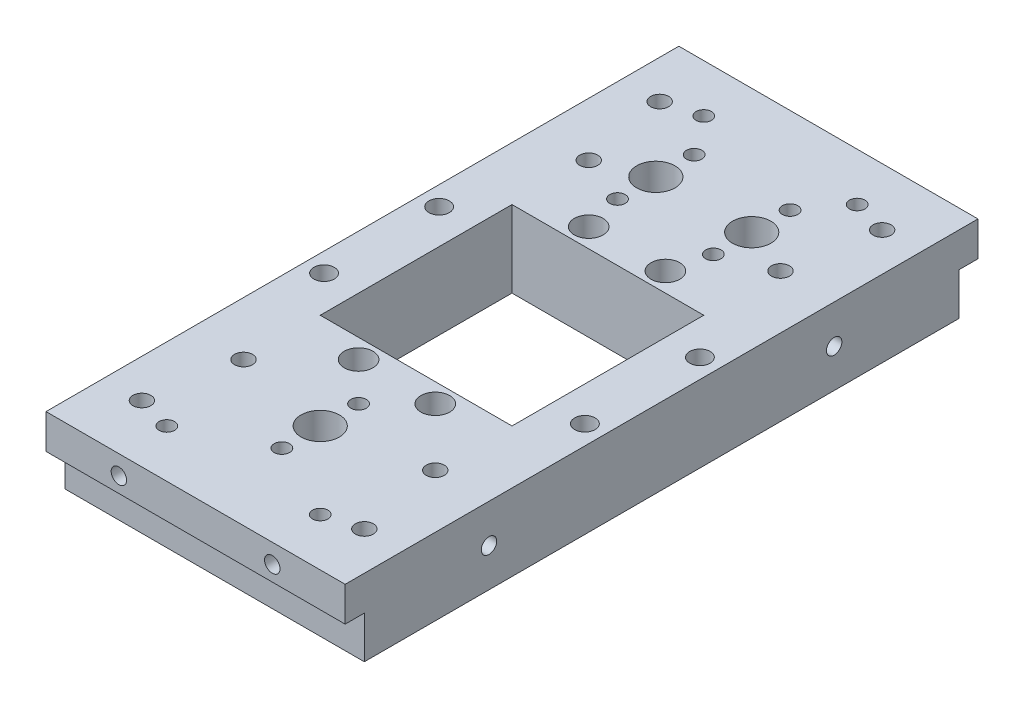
SolidWorks part; units mm, degrees
ref_plane "Front Plane" through (0, 0, 0) normal (0, 0, 1) x (1, 0, 0)
ref_plane "Top Plane" through (0, 0, 0) normal (0, 1, 0) x (1, 0, 0)
ref_plane "Right Plane" through (0, 0, 0) normal (1, 0, 0) x (0, 0, -1)
sketch "Sketch1" plane through (0, 0, 0) normal (0, 1, 0) x (1, 0, 0)
  line L1 (-49.53, 104.775) -> (49.53, 104.775)
  line L2 (-49.53, 104.775) -> (-49.53, -104.775)
  line L3 (-49.53, -104.775) -> (49.53, -104.775)
  line L4 (49.53, 104.775) -> (49.53, -104.775)
  dimension "D1" = 49.53
  dimension "D2" = 49.53
  dimension "D3" = 104.775
  dimension "D4" = 104.775
extrude "Boss-Extrude1" add sketch "Sketch1" along normal mid plane 25.4
sketch "Sketch2" plane through (0, 12.7, 0) normal (0, 1, 0) x (1, 0, 0)
  line L1 (-31.75, 31.75) -> (31.75, 31.75)
  line L2 (-31.75, 31.75) -> (-31.75, -31.75)
  line L3 (-31.75, -31.75) -> (31.75, -31.75)
  line L4 (31.75, 31.75) -> (31.75, -31.75)
  dimension "D1" = 31.75
  dimension "D2" = 31.75
  dimension "D3" = 31.75
  dimension "D4" = 31.75
extrude "Cut-Extrude1" cut sketch "Sketch2" against normal blind 25.4
hole_wizard "1/4-20 Tapped Hole1" positions "Sketch5" profile "Sketch4" tap size "1/4-20" standard "ANSI Inch"
sketch "Sketch5" plane through (0, 0, 104.775) normal (0, 0, 1) x (1, 0, 0)
  line L0 (-49.53, 12.7) -> (49.53, 12.7) construction
  point P0 (-25.4, 6.35)
  point P2 (25.4, 6.35)
  dimension "D1" = 25.4
  dimension "D2" = 25.4
  dimension "D3" = 6.35
sketch "Sketch4" plane through (-25.4, 6.35, 104.775) normal (1, 0, 0) x (0, -1, 0)
  line L0 (0, 0) -> (0, 20.5838)
  line L1 (0, 20.5838) -> (2.5527, 19.05)
  line L2 (2.5527, 19.05) -> (2.5527, 0)
  line L5 (2.5527, 0) -> (0, 0)
  line L10 (0, 20.5838) -> (-2.5527, 19.05) construction
  line L11 (0, -6.35) -> (0, 107.95) construction
  dimension "Tap Drill Dia." = 5.1054
  dimension "Tap Drill Depth" = 19.05
  dimension "Drill Angle" = 118
hole_wizard "CBORE for 1/4 Socket Head Cap Screw1" positions "Sketch7" profile "Sketch6" counterbore size "1/4" standard "ANSI Inch"
sketch "Sketch7" plane through (0, -12.7, 0) normal (0, -1, 0) x (-1, 0, 0)
  point P0 (43.18, 19.05)
  point P2 (43.18, -19.05)
  point P4 (-43.18, -19.05)
  point P6 (-43.18, 19.05)
  dimension "D1" = 19.05
  dimension "D2" = 19.05
  dimension "D3" = 43.18
  dimension "D4" = 43.18
sketch "Sketch6" plane through (-43.18, -12.7, -19.05) normal (1, 0, 0) x (0, 0, -1)
  line L0 (0, 0) -> (0, 25.4)
  line L1 (0, 25.4) -> (3.3782, 25.4)
  line L3 (3.3782, 25.4) -> (3.3782, 6.35)
  line L4 (3.3782, 6.35) -> (5.5562, 6.35)
  line L5 (5.5562, 6.35) -> (5.5562, 0)
  line L7 (5.5562, 0) -> (0, 0)
  line L11 (0, -6.35) -> (0, 107.95) construction
  dimension "Thru Hole Dia." = 6.7564
  dimension "Thru Hole Depth" = 25.4
  dimension "C'Bore Dia." = 11.1125
  dimension "C'Bore Depth" = 6.35
hole_wizard "15/64 (0.23438) Diameter Hole1" positions "Sketch9" profile "Sketch8" hole size "15/64" standard "ANSI Inch"
sketch "Sketch9" plane through (0, 12.7, 0) normal (0, 1, 0) x (1, 0, 0)
  line L0 (49.53, -104.775) -> (49.53, 104.775) construction
  line L1 (-49.53, 104.775) -> (-49.53, -104.775) construction
  line L2 (49.53, 104.775) -> (-49.53, 104.775) construction
  line L3 (-49.53, -104.775) -> (49.53, -104.775) construction
  line L4 (31.75, 31.75) -> (-31.75, 31.75) construction
  line L5 (-31.75, -31.75) -> (31.75, -31.75) construction
  point P0 (-36.83, 85.725)
  point P2 (36.83, 85.725)
  point P4 (36.83, -85.725)
  point P6 (-36.83, -85.725)
  point P18 (-31.75, -57.15)
  point P20 (31.75, -57.15)
  point P22 (31.75, 57.15)
  point P24 (-31.75, 57.15)
  dimension "D1" = 12.7
  dimension "D2" = 12.7
  dimension "D3" = 19.05
  dimension "D4" = 19.05
  dimension "D5" = 31.75
  dimension "D6" = 31.75
  dimension "D7" = 25.4
  dimension "D8" = 25.4
sketch "Sketch8" plane through (-36.83, 12.7, -85.725) normal (1, 0, 0) x (0, 0, 1)
  line L0 (0, 0) -> (0, 25.4)
  line L1 (0, 25.4) -> (2.9766, 25.4)
  line L2 (2.9766, 25.4) -> (2.9766, 0)
  line L5 (2.9766, 0) -> (0, 0)
  line L11 (0, -6.35) -> (0, 107.95) construction
  dimension "Thru Hole Dia." = 5.9533
  dimension "Thru Hole Depth" = 25.4
hole_wizard "1/2 (0.5) Diameter Hole1" positions "Sketch11" profile "Sketch10" hole size "1/2" standard "ANSI Inch"
sketch "Sketch11" plane through (0, 12.7, 0) normal (0, 1, 0) x (1, 0, 0)
  point P0 (0, -63.5)
  point P2 (-15.875, 63.5)
  point P4 (15.875, 63.5)
  dimension "D1" = 15.875
  dimension "D2" = 15.875
  dimension "D3" = 63.5
  dimension "D4" = 63.5
sketch "Sketch10" plane through (0, 12.7, 63.5) normal (1, 0, 0) x (0, 0, 1)
  line L0 (0, 0) -> (0, 25.4)
  line L1 (0, 25.4) -> (6.35, 25.4)
  line L2 (6.35, 25.4) -> (6.35, 0)
  line L5 (6.35, 0) -> (0, 0)
  line L11 (0, -6.35) -> (0, 107.95) construction
  dimension "Thru Hole Dia." = 12.7
  dimension "Thru Hole Depth" = 25.4
mirror "Mirror1" about plane through (0, 0, 0) normal (0, 0, 1) of "1/4-20 Tapped Hole1"
hole_wizard "1/4-20 Tapped Hole4" positions "Sketch13" profile "Sketch12" tap size "1/4-20" standard "ANSI Inch"
sketch "Sketch13" plane through (49.53, 0, 0) normal (1, 0, 0) x (0, 0, -1)
  point P0 (-57.15, 0)
  point P2 (57.15, 0)
  dimension "D1" = 57.15
  dimension "D2" = 57.15
sketch "Sketch12" plane through (49.53, 0, 57.15) normal (0, 1, 0) x (0, 0, -1)
  line L0 (0, 0) -> (0, 21.8538)
  line L1 (0, 21.8538) -> (2.5527, 20.32)
  line L2 (2.5527, 20.32) -> (2.5527, 0)
  line L5 (2.5527, 0) -> (0, 0)
  line L10 (0, 21.8538) -> (-2.5527, 20.32) construction
  line L11 (0, -6.35) -> (0, 107.95) construction
  dimension "Tap Drill Dia." = 5.1054
  dimension "Tap Drill Depth" = 20.32
  dimension "Drill Angle" = 118
mirror "Mirror2" about plane through (0, 0, 0) normal (1, 0, 0) of "1/4-20 Tapped Hole4"
sketch "Sketch15" plane through (0, 12.7, 0) normal (0, 1, 0) x (1, 0, 0)
  circle A0 centre (12.7, -38.1) radius 4.7625
  circle A1 centre (-12.7, -38.1) radius 4.7625
  dimension "D1" = 12.7
  dimension "D2" = 12.7
  dimension "D3" = 38.1
extrude "Cut-Extrude2" cut sketch "Sketch15" against normal up to next
mirror "Mirror3" about plane through (0, 0, 0) normal (0, 0, 1) of "Cut-Extrude2"
hole_wizard "1/4-20 Tapped Hole5" positions "Sketch17" profile "Sketch16" tap size "1/4-20" standard "ANSI Inch"
sketch "Sketch17" plane through (0, 12.7, 0) normal (0, 1, 0) x (1, 0, 0)
  circle A0 centre (0, -63.5) radius 6.35 construction
  circle A1 centre (15.875, 63.5) radius 6.35 construction
  point P0 (0, -76.2)
  point P2 (0, -50.8)
  point P4 (15.875, 50.8)
  point P6 (15.875, 76.2)
  point P8 (-15.875, 50.8)
  point P10 (-15.875, 76.2)
  dimension "D1" = 12.7
  dimension "D2" = 12.7
  dimension "D3" = 12.7
  dimension "D4" = 12.7
  dimension "D5" = 15.875
  dimension "D6" = 15.875
sketch "Sketch16" plane through (0, 12.7, 76.2) normal (1, 0, 0) x (0, 0, 1)
  line L0 (0, 0) -> (0, 25.4)
  line L1 (0, 25.4) -> (2.5527, 25.4)
  line L2 (2.5527, 25.4) -> (2.5527, 0)
  line L5 (2.5527, 0) -> (0, 0)
  line L11 (0, -6.35) -> (0, 107.95) construction
  dimension "Thru Tap Drill Dia." = 5.1054
  dimension "Thru Tap Drill Depth" = 25.4
hole_wizard "1/4-20 Tapped Hole6" positions "Sketch19" profile "Sketch18" tap size "1/4-20" standard "ANSI Inch"
sketch "Sketch19" plane through (0, 12.7, 0) normal (0, 1, 0) x (1, 0, 0)
  line L0 (-49.53, -104.775) -> (49.53, -104.775) construction
  point P0 (-25.4, -88.9)
  point P2 (25.4, -88.9)
  dimension "D1" = 25.4
  dimension "D2" = 25.4
  dimension "D3" = 15.875
sketch "Sketch18" plane through (-25.4, 12.7, 88.9) normal (1, 0, 0) x (0, 0, 1)
  line L0 (0, 0) -> (0, 25.4)
  line L1 (0, 25.4) -> (2.5527, 25.4)
  line L2 (2.5527, 25.4) -> (2.5527, 0)
  line L5 (2.5527, 0) -> (0, 0)
  line L11 (0, -6.35) -> (0, 107.95) construction
  dimension "Thru Tap Drill Dia." = 5.1054
  dimension "Thru Tap Drill Depth" = 25.4
mirror "Mirror4" about plane through (0, 0, 0) normal (0, 0, 1) of "1/4-20 Tapped Hole6"
sketch "Sketch20" plane through (49.53, 0, 0) normal (1, 0, 0) x (0, 0, -1)
  line L0 (-104.775, 12.7) -> (104.775, 12.7) construction
  line L1 (-104.775, -12.7) -> (-98.425, -12.7)
  line L2 (-104.775, -12.7) -> (-104.775, 1.27)
  line L3 (-104.775, 1.27) -> (-98.425, 1.27)
  line L4 (-98.425, -12.7) -> (-98.425, 1.27)
  dimension "D1" = 6.35
  dimension "D2" = 11.43
extrude "Cut-Extrude3" cut sketch "Sketch20" against normal up to next
mirror "Mirror5" about plane through (0, 0, 0) normal (0, 0, 1) of "Cut-Extrude3"
